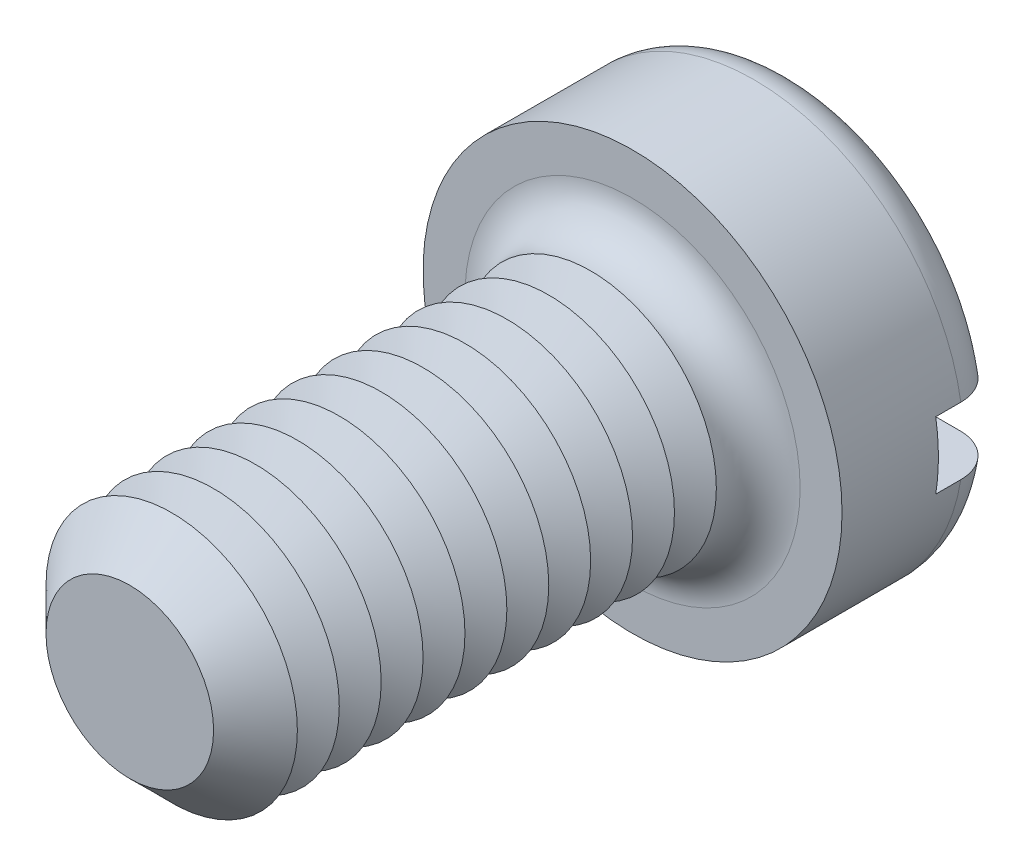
SolidWorks part; units mm, degrees
ref_plane "Front Plane" through (0, 0, 0) normal (0, 0, 1) x (1, 0, 0)
ref_plane "Top Plane" through (0, 0, 0) normal (0, 1, 0) x (1, 0, 0)
ref_plane "Right Plane" through (0, 0, 0) normal (1, 0, 0) x (0, 0, -1)
sketch "Sketch3" plane through (0, 0, 0) normal (0, 0, 1) x (1, 0, 0)
  circle A0 centre (0, 0) radius 5
  dimension "D1" = 10
extrude "Boss-Extrude2" add sketch "Sketch3" against normal blind 3.9
sketch "Sketch4" plane through (0, 0, 0) normal (0, 0, 1) x (1, 0, 0)
  circle A0 centre (0, 0) radius 3
  dimension "D1" = 6
extrude "Boss-Extrude3" add sketch "Sketch4" along normal blind 12
fillet "Fillet1" radius 1 2 edges at (5, 0, -3.9) (3, 0, 0)
chamfer "Chamfer1" distance 1 angle 45 1 edges at (3, 0, 12)
sketch "Sketch5" plane through (0, 0, 0) normal (1, 0, 0) x (0, 0, -1)
  line L0 (1.6944, 0) -> (-7.6738, 0) construction
sketch "Sketch6" plane through (0, 0, 0) normal (1, 0, 0) x (0, 0, -1)
  line L0 (-1, 3) -> (-1.5, 2.134)
  line L1 (-1.5, 2.134) -> (-2, 3)
  line L2 (-1, 3) -> (-11, 3) construction
  line L3 (-2, 3) -> (-1, 3)
  dimension "D1" = 1
revolve "Cut-Revolve1" cut sketch "Sketch6" angle 360 about L0
pattern_linear "LPattern1" count 10 spacing 1 along (0, 0, 1) of "Cut-Revolve1"
sketch "Sketch8" plane through (0, 0, -3.9) normal (0, 0, -1) x (-1, 0, 0)
  line L1 (5, -0.8) -> (-5, -0.8)
  line L2 (5, -0.8) -> (5, 0.8)
  line L3 (5, 0.8) -> (-5, 0.8)
  line L4 (-5, -0.8) -> (-5, 0.8)
  line L5 (5, -0.8) -> (-5, 0.8) construction
  line L6 (5, 0.8) -> (-5, -0.8) construction
  point P0 (0, 0)
  dimension "D1" = 10
  dimension "D2" = 1.6
extrude "Cut-Extrude1" cut sketch "Sketch8" against normal blind 1.6
